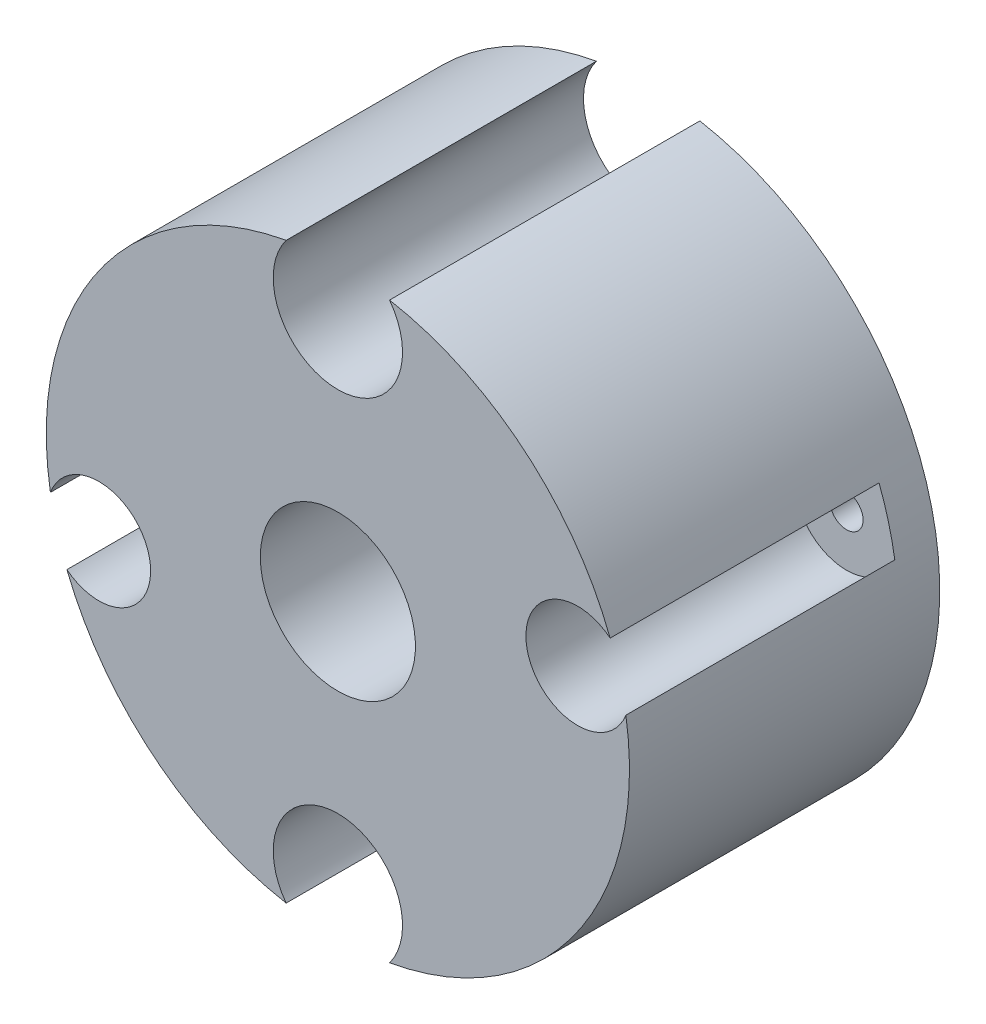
SolidWorks part; units mm, degrees
ref_plane "Front Plane" through (0, 0, 0) normal (0, 0, 1) x (1, 0, 0)
ref_plane "Top Plane" through (0, 0, 0) normal (0, 1, 0) x (1, 0, 0)
ref_plane "Right Plane" through (0, 0, 0) normal (1, 0, 0) x (0, 0, -1)
sketch "Sketch1" plane through (0, 0, 0) normal (0, 0, 1) x (1, 0, 0)
  arc A0 (-3.175, 17.6205) -> (-3.175, -17.6205) centre (0, 0) ccw
  circle A1 centre (0, 0) radius 4.7625
  arc A2 (3.175, -17.6205) -> (3.175, 17.6205) centre (0, 0) ccw
  arc A3 (-3.175, 17.6205) -> (3.175, 17.6205) centre (0, 15.2393) ccw
  arc A4 (3.175, -17.6205) -> (-3.175, -17.6205) centre (0, -15.2393) ccw
  circle A5 centre (14.7207, 3.9444) radius 1.016
  circle A6 centre (-14.6714, -4.124) radius 1.016
extrude "Extrude1" add sketch "Sketch1" along normal blind 19.05
sketch "Sketch3" plane through (0, 0, 19.05) normal (0, 0, 1) x (1, 0, 0)
  line L1 (16.7159, 6.4142) -> (17.6835, 2.8031)
  line L2 (17.6835, 2.8031) -> (17.7787, 2.8241)
  circle A0 centre (-14.6714, -4.124) radius 3.175
  arc A3 (3.175, -17.6205) -> (3.175, 17.6205) centre (0, 0) ccw construction
extrude "Cut-Extrude1" cut sketch "Sketch3" against normal blind 16.51 contours A0
sketch "Sketch5" plane through (0, 0, 19.05) normal (0, 0, 1) x (1, 0, 0)
  circle A0 centre (14.7207, 3.9444) radius 3.175
extrude "Cut-Extrude2" cut sketch "Sketch5" against normal blind 16.51
sketch "Sketch6" plane through (0, 0, 0) normal (0, 0, -1) x (-1, 0, 0)
  circle A0 centre (0, 0) radius 7.9375
extrude "Cut-Extrude3" cut sketch "Sketch6" against normal blind 5.08
chamfer "Chamfer1" distance 3.175 angle 45 1 edges at (-4.7625, 0, 5.08)
